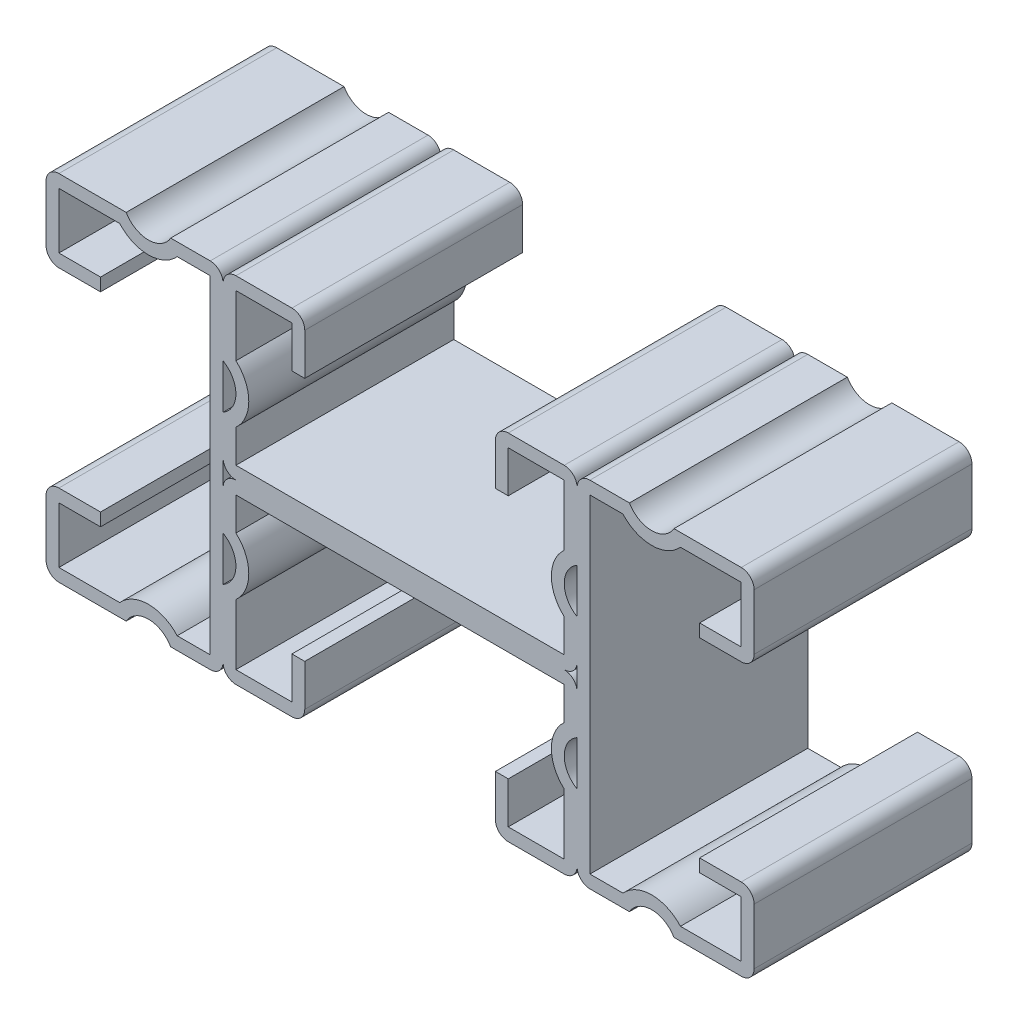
SolidWorks part; units mm, degrees
ref_plane "Plane1" through (0, 0, 0) normal (0, 0, 1) x (1, 0, 0)
ref_plane "Plane2" through (0, 0, 0) normal (0, 1, 0) x (1, 0, 0)
ref_plane "Plane3" through (0, 0, 0) normal (1, 0, 0) x (0, 0, -1)
sketch "Sketch1" plane through (0, 0, 0) normal (0, 0, 1) x (1, 0, 0)
  line L0 (-20.6375, 19.1389) -> (-20.6375, 11.2952)
  line L1 (-20.6375, 6.1038) -> (-20.6375, 1.4986)
  line L2 (-19.1389, 0) -> (19.1389, 0)
  line L3 (20.6375, 1.4986) -> (20.6375, 6.1038)
  line L4 (20.6375, 11.2952) -> (20.6375, 19.1389)
  line L5 (19.1389, 20.6375) -> (12.6111, 20.6375)
  line L6 (11.1125, 19.1389) -> (11.1125, 14.2875)
  line L7 (-19.1389, 20.6375) -> (-12.6111, 20.6375)
  line L8 (-11.1125, 19.1389) -> (-11.1125, 14.2875)
  line L9 (19.1389, 3.4236) -> (19.1389, 6.4516) construction
  line L10 (-19.1389, 15.1511) -> (-19.1389, 3.4236) construction
  line L11 (-12.6111, 19.1389) -> (-12.6111, 14.2875)
  line L12 (-19.1389, 19.1389) -> (-12.6111, 19.1389)
  line L13 (-19.1389, 19.1389) -> (-19.1389, 12.0505)
  line L14 (-19.1389, 5.3485) -> (-19.1389, 1.4986)
  line L15 (-19.1389, 1.4986) -> (19.1389, 1.4986)
  line L16 (19.1389, 1.4986) -> (19.1389, 5.3485)
  line L17 (19.1389, 12.0505) -> (19.1389, 19.1389)
  line L18 (19.1389, 19.1389) -> (12.6111, 19.1389)
  line L19 (12.6111, 19.1389) -> (12.6111, 14.2875)
  line L20 (-12.6111, 14.2875) -> (-11.1125, 14.2875)
  line L21 (11.1125, 14.2875) -> (12.6111, 14.2875)
  arc A0 (20.6375, 11.2952) -> (20.6375, 6.1038) centre (22.1361, 8.6995) ccw
  arc A1 (-20.6375, 6.1038) -> (-20.6375, 11.2952) centre (-22.1361, 8.6995) ccw
  arc A2 (-12.6111, 20.6375) -> (-11.1125, 19.1389) centre (-12.6111, 19.1389) cw
  arc A3 (-20.6375, 19.1389) -> (-19.1389, 20.6375) centre (-19.1389, 19.1389) cw
  arc A4 (-19.1389, 0) -> (-20.6375, 1.4986) centre (-19.1389, 1.4986) cw
  arc A5 (20.6375, 1.4986) -> (19.1389, 0) centre (19.1389, 1.4986) cw
  arc A6 (19.1389, 20.6375) -> (20.6375, 19.1389) centre (19.1389, 19.1389) cw
  arc A7 (11.1125, 19.1389) -> (12.6111, 20.6375) centre (12.6111, 19.1389) cw
  arc A8 (-19.1389, 5.3485) -> (-19.1389, 12.0505) centre (-22.1361, 8.6995) ccw
  arc A9 (19.1389, 12.0505) -> (19.1389, 5.3485) centre (22.1361, 8.6995) ccw
  dimension "D1" = 20.6375
  dimension "D9" = 2.9972
  dimension "D10" = 2.9972
  dimension "D2" = 8.6995
  dimension "Width" = 41.275
  dimension "D6" = 22.225
  dimension "edge" = 9.525
  dimension "Lip" = 6.35
  dimension "gauge" = 1.4986
extrude "Base-Extrude" add sketch "Sketch1" along normal mid plane 25.4
mirror "Mirror1" about plane through (0, 0, 0) normal (0, 1, 0) of "Base-Extrude"
sketch "Sketch2" plane through (20.1612, 0.1588, 0) normal (0, 0, 1) x (0, -1, 0)
  line L0 (-20.4788, 19.6152) -> (-20.4788, 11.7714)
  line L1 (-20.4788, 6.5801) -> (-20.4788, 1.9749)
  line L2 (-18.9802, 0.4763) -> (19.2976, 0.4763)
  line L3 (20.7962, 1.9749) -> (20.7962, 6.5801)
  line L4 (20.7962, 11.7714) -> (20.7962, 19.6152)
  line L5 (19.2977, 21.1138) -> (12.7698, 21.1138)
  line L6 (11.2712, 19.6152) -> (11.2712, 14.7638)
  line L7 (-18.9802, 21.1138) -> (-12.4523, 21.1138)
  line L8 (-10.9538, 19.6152) -> (-10.9538, 14.7638)
  line L9 (19.2976, 3.8998) -> (19.2976, 6.9279) construction
  line L10 (-18.9802, 15.6274) -> (-18.9802, 3.8998) construction
  line L11 (-12.4523, 19.6152) -> (-12.4524, 14.7638)
  line L12 (-18.9802, 19.6152) -> (-12.4523, 19.6152)
  line L13 (-18.9802, 19.6152) -> (-18.9802, 12.5267)
  line L14 (-18.9802, 5.8248) -> (-18.9802, 1.9749)
  line L15 (-18.9802, 1.9749) -> (19.2976, 1.9749)
  line L16 (19.2976, 1.9749) -> (19.2976, 5.8248)
  line L17 (19.2977, 12.5267) -> (19.2977, 19.6152)
  line L18 (19.2977, 19.6152) -> (12.7698, 19.6152)
  line L19 (12.7698, 19.6152) -> (12.7698, 14.7638)
  line L20 (-12.4524, 14.7638) -> (-10.9538, 14.7638)
  line L21 (11.2712, 14.7638) -> (12.7698, 14.7638)
  arc A0 (20.7962, 11.7714) -> (20.7962, 6.5801) centre (22.2948, 9.1758) ccw
  arc A1 (-20.4788, 6.5801) -> (-20.4788, 11.7714) centre (-21.9774, 9.1758) ccw
  arc A2 (-12.4523, 21.1138) -> (-10.9538, 19.6152) centre (-12.4523, 19.6152) cw
  arc A3 (-20.4788, 19.6152) -> (-18.9802, 21.1138) centre (-18.9802, 19.6152) cw
  arc A4 (-18.9802, 0.4763) -> (-20.4788, 1.9749) centre (-18.9802, 1.9749) cw
  arc A5 (20.7962, 1.9749) -> (19.2976, 0.4763) centre (19.2976, 1.9749) cw
  arc A6 (19.2977, 21.1138) -> (20.7962, 19.6152) centre (19.2977, 19.6152) cw
  arc A7 (11.2712, 19.6152) -> (12.7698, 21.1138) centre (12.7698, 19.6152) cw
  arc A8 (-18.9802, 5.8248) -> (-18.9802, 12.5267) centre (-21.9774, 9.1758) ccw
  arc A9 (19.2977, 12.5267) -> (19.2976, 5.8248) centre (22.2948, 9.1758) ccw
  dimension "D1" = 20.6375
  dimension "D9" = 2.9972
  dimension "D10" = 2.9972
  dimension "D2" = 8.6995
  dimension "D3" = 20.6375
  dimension "Width" = 41.275
  dimension "D6" = 22.225
  dimension "edge" = 9.525
  dimension "Lip" = 6.35
  dimension "D4" = 20.6375
  dimension "gauge" = 1.4986
extrude "Boss-Extrude1" add sketch "Sketch2" along normal mid plane 25.4
mirror "Mirror2" about plane through (0, 0, 0) normal (1, 0, 0) of "Boss-Extrude1"
equation "\"D1@Sketch1\" = \"Width@Sketch1\" / 2"
equation "\"D6@Sketch1\" = \"Width@Sketch1\" - 2 * \"edge@Sketch1\""
equation "\"D10@Sketch1\" = 2 * \"gauge@Sketch1\""
equation "\"D9@Sketch1\" = \"D10@Sketch1\""
equation "\"D1@Boss-Extrude1\" = \"D1@Base-Extrude\""
